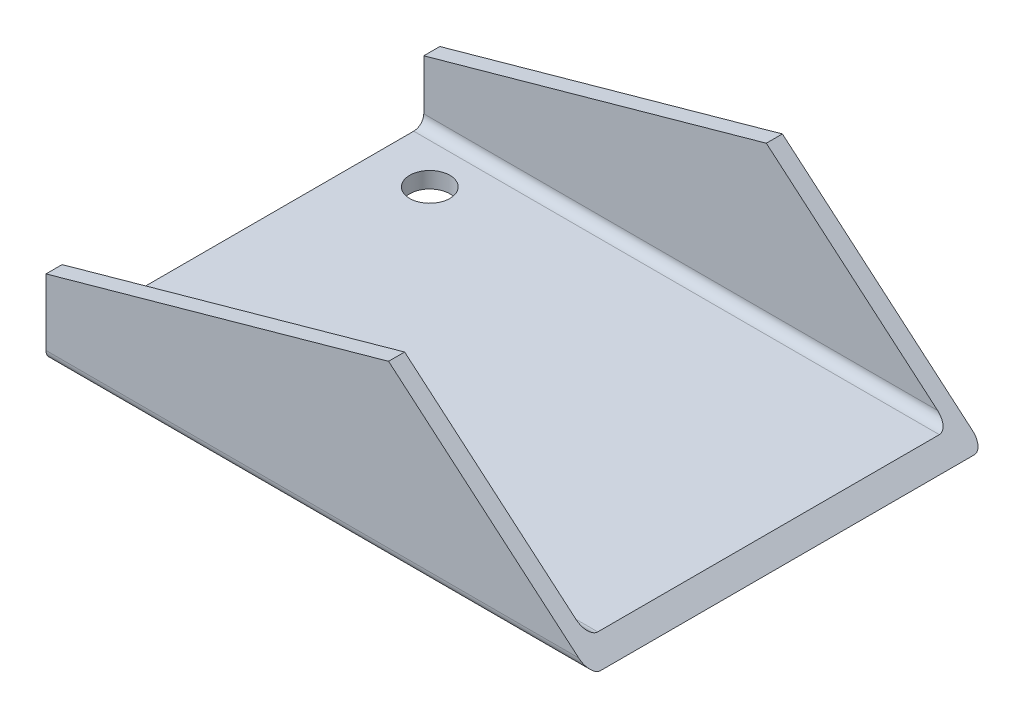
SolidWorks part; units mm, degrees
ref_plane "前视基准面" through (0, 0, 0) normal (0, 0, 1) x (1, 0, 0)
ref_plane "上视基准面" through (0, 0, 0) normal (0, 1, 0) x (1, 0, 0)
ref_plane "右视基准面" through (0, 0, 0) normal (1, 0, 0) x (0, 0, -1)
sketch "草图1" plane through (0, 0, 0) normal (0, 0, 1) x (1, 0, 0)
  line L0 (-271, 0) -> (0, 0)
  dimension "D3" = 271
sheet metal parameters "钣金1" thickness 8 parameters "D1"=0.7366
base flange "基体-法兰1" sketch "草图1" end condition mid plane depth 180 reverse direction no thickness 8 reverse thickness direction no bend radius 0.7366
sketch "草图15" plane through (0, 0, 0) normal (0, 1, 0) x (-1, 0, 0)
  line L0 (0, 0) -> (369.3277, 0) construction
  line L1 (243, -61.9025) -> (243, 55.7994) construction
  line L2 (271, 90) -> (271, -90) construction
  circle A0 centre (243, -65) radius 10
  circle A1 centre (243, 65) radius 10
  dimension "D2" = 130
  dimension "D3" = 65
  dimension "D4" = 20
  dimension "D5" = 20
  dimension "D1" = 28
extrude "切除-拉伸1" cut sketch "草图15" against normal through all
sketch "草图16" plane through (0, 0, 90) normal (0, 0, 1) x (1, 0, 0)
  line L0 (0, -8) -> (-100.5111, 77.5659)
  line L1 (-100.5111, 77.5659) -> (-271, 30)
  line L2 (-271, 30) -> (-271, -8)
  line L3 (-271, -8) -> (0, -8)
  dimension "D1" = 38
  dimension "D2" = 177
  dimension "D3" = 132
extrude "拉伸1" add sketch "草图16" along normal blind 8
mirror "镜向1" about plane through (0, 0, 0) normal (0, 0, 1) of "拉伸1"
sketch "草图17" plane through (0, 0, 90) normal (0, 0, 1) x (1, 0, 0)
  line L3 (-9.3973, 0) -> (0, -8)
  line L4 (0, -8) -> (0, 0)
  line L5 (0, 0) -> (-9.3973, 0)
  line L6 (-9.3973, 0) -> (0, -8)
  line L7 (0, -8) -> (0, 0)
  line L8 (0, 0) -> (-9.3973, 0)
  dimension "D1" = 0
extrude "拉伸4" cut sketch "草图17" against normal through all
fillet "圆角1" radius 5 4 edges at (-135.5, -8, 98) (-135.5, -8, -98)
flat pattern "平板型式1"
sketch "折弯-线1" plane through (0, 0, 0) normal (0, 1, 0) x (-1, 0, 0)
